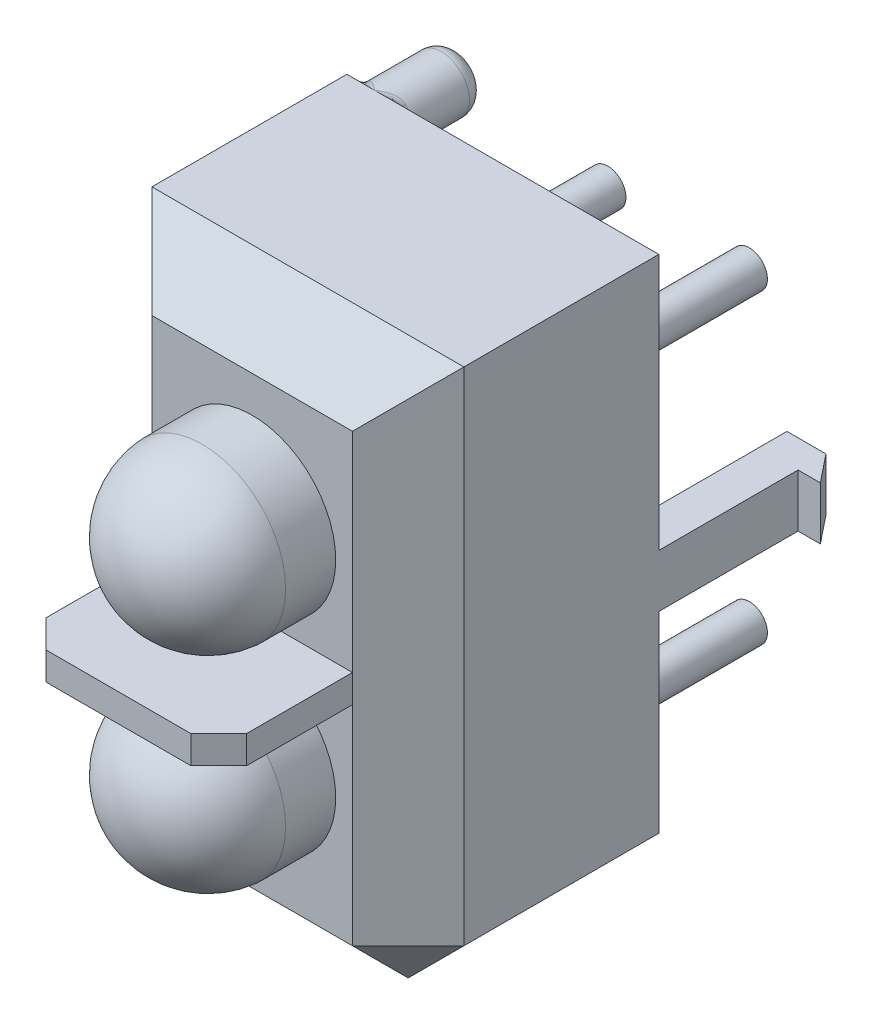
SolidWorks part; units mm, degrees
ref_plane "Front Plane" through (0, 0, 0) normal (0, 0, 1) x (1, 0, 0)
ref_plane "Top Plane" through (0, 0, 0) normal (0, 1, 0) x (1, 0, 0)
ref_plane "Right Plane" through (0, 0, 0) normal (1, 0, 0) x (0, 0, -1)
sketch "Sketch1" plane through (0, 0, 0) normal (0, 0, 1) x (1, 0, 0)
  line L1 (-2.8, 5) -> (2.8, 5)
  line L2 (-2.8, 5) -> (-2.8, -5)
  line L3 (-2.8, -5) -> (2.8, -5)
  line L4 (2.8, 5) -> (2.8, -5)
  line L5 (-2.8, 5) -> (2.8, -5) construction
  line L6 (-2.8, -5) -> (2.8, 5) construction
  point P0 (0, 0)
  dimension "D1" = 10
  dimension "D2" = 5.6
extrude "Boss-Extrude1" add sketch "Sketch1" along normal blind 4.5
chamfer "Chamfer1" distance 1 angle 45 6 edges at (2.8, -5, 2.25) (-2.8, -5, 2.25) (2.8, 0, 4.5) (0, -5, 4.5) (0, 5, 4.5) (-2.8, 0, 4.5)
sketch "Sketch2" plane through (0, 0, 4.5) normal (0, 0, 1) x (1, 0, 0)
  line L0 (0, 1.85) -> (0, -1.85) construction
  line L1 (-1.6378, 0) -> (1.752, 0) construction
  circle A0 centre (0, 1.85) radius 1.5
  circle A1 centre (0, -1.85) radius 1.5
  dimension "D2" = 3
  dimension "D3" = 3
  dimension "D1" = 3.7
extrude "Boss-Extrude2" add sketch "Sketch2" along normal blind 0.9
dome "Dome1" faces to dome 2 distance 1.4 parameters "D1"=1.4
dome "Dome2" faces to dome 2 distance 1.4 parameters "D1"=1.4
sketch "Sketch3" plane through (0, 0, 4.5) normal (0, 0, 1) x (1, 0, 0)
  line L0 (1.8, -4) -> (1.8, 4) construction
  line L1 (-1.8, -0.25) -> (1.8, -0.25)
  line L2 (-1.8, -0.25) -> (-1.8, 0.25)
  line L3 (-1.8, 0.25) -> (1.8, 0.25)
  line L4 (1.8, -0.25) -> (1.8, 0.25)
  line L5 (-1.8, -0.25) -> (1.8, 0.25) construction
  line L6 (-1.8, 0.25) -> (1.8, -0.25) construction
  point P0 (0, 0)
  dimension "D1" = 0.5
extrude "Boss-Extrude3" add sketch "Sketch3" along normal blind 2.4
chamfer "Chamfer2" distance 0.5 angle 45 2 edges at (-1.8, 0, 6.9) (1.8, 0, 6.9)
sketch "Sketch4" plane through (0, 0, 0) normal (0, 0, -1) x (-1, 0, 0)
  line L1 (2.8, 5) -> (2.8, -4) construction
  circle A0 centre (2.3, 4.5) radius 0.5
  dimension "D1" = 1
  dimension "D2" = 0.5
  dimension "D3" = 0.5
extrude "Boss-Extrude4" add sketch "Sketch4" along normal blind 1.5
fillet "Fillet1" radius 0.3 1 edges at (-2.8, 4.5, -1.5)
fillet "Fillet2" radius 0.2 2 edges at (-1.9464, 4.1464, 0) (-2.6536, 4.8536, 0)
sketch "Sketch5" plane through (0, 0, 0) normal (0, 0, -1) x (-1, 0, 0)
  line L0 (2.3556, 4.3522) -> (2.3556, -5.5035) construction
  line L1 (2.3556, 4.4706) -> (-4.7497, 4.4706) construction
  line L2 (2.3556, -0.1794) -> (-4.7497, -0.1794) construction
  line L3 (-0.0944, 4.3522) -> (-0.0944, -5.5035) construction
  line L4 (-1.9944, 4.3522) -> (-1.9944, -5.5035) construction
  line L5 (1.8056, 4.3522) -> (1.8056, -5.5035) construction
  line L6 (-2.8, -4) -> (-2.8, 5) construction
  line L7 (-2.1, -0.5521) -> (-2.8, -0.5521)
  line L8 (-2.1, -0.5521) -> (-2.1, 0.3979)
  line L9 (-2.1, 0.3979) -> (-2.8, 0.3979)
  line L10 (-2.8, -0.5521) -> (-2.8, 0.3979)
  line L11 (-2.1, -0.5521) -> (-2.8, 0.3979) construction
  line L12 (-2.1, 0.3979) -> (-2.8, -0.5521) construction
  line L13 (2.8, -0.5521) -> (2.1, -0.5521)
  line L14 (2.8, -0.5521) -> (2.8, 0.3979)
  line L15 (2.8, 0.3979) -> (2.1, 0.3979)
  line L16 (2.1, -0.5521) -> (2.1, 0.3979)
  line L17 (2.8, -0.5521) -> (2.1, 0.3979) construction
  line L18 (2.8, 0.3979) -> (2.1, -0.5521) construction
  line L19 (-2.1, -0.5521) -> (2.8, -0.5521) construction
  line L20 (2.8, 4.0101) -> (2.8, -4) construction
  dimension "D4" = 0.95
  dimension "D5" = 0.7
  dimension "D6" = 0
  dimension "D9" = 0
  dimension "D1" = 2.45
  dimension "D2" = 1.9
  dimension "D3" = 1.9
  dimension "D7" = 2
extrude "Boss-Extrude5" add sketch "Sketch5" along normal blind 3
sketch "Sketch8" plane through (0, 0, 0) normal (0, 0, -1) x (-1, 0, 0)
  line L0 (2.3, 4.5062) -> (2.3, -7.5109) construction
  line L1 (-0.155, 4.5062) -> (-0.155, -7.5109) construction
  line L2 (2.3, 4.5) -> (-6.037, 4.5) construction
  line L3 (2.3, -0.15) -> (-6.037, -0.15) construction
  line L5 (2.3, 2.59) -> (-6.037, 2.59) construction
  line L6 (2.3, -2.89) -> (-6.037, -2.89) construction
  line L7 (-1.425, 4.5062) -> (-1.425, -7.5109) construction
  line L8 (1.115, 4.5062) -> (1.115, -7.5109) construction
  line L9 (-1.425, 2.59) -> (1.115, 2.59) construction
  circle A0 centre (-1.425, 2.59) radius 0.325
  circle A1 centre (1.115, 2.59) radius 0.325
  circle A2 centre (1.115, -2.91) radius 0.325
  circle A3 centre (-1.425, -2.91) radius 0.325
  dimension "D6" = 0.65
  dimension "D7" = 2
  dimension "D9" = 2.54
  dimension "D1" = 4.65
  dimension "D2" = 2.74
  dimension "D3" = 2.74
  dimension "D4" = 1.27
  dimension "D5" = 1.27
  dimension "D8" = 2
extrude "Boss-Extrude6" add sketch "Sketch8" along normal blind 3 separate body
sketch "Sketch9" plane through (2.8, 0, 0) normal (1, 0, 0) x (0, 0, -1)
  line L0 (3, -0.5521) -> (0, -0.5521) construction
  line L1 (3, 0.3979) -> (2.5, 0.3979)
  line L2 (3, 0.3979) -> (3, -0.5521)
  line L3 (3, -0.5521) -> (2.5, -0.5521)
  line L4 (2.5, 0.3979) -> (2.5, -0.5521)
  dimension "D1" = 0.5
extrude "Boss-Extrude7" add sketch "Sketch9" along normal blind 0.4
sketch "Sketch10" plane through (0, -0.5521, 0) normal (0, -1, 0) x (1, 0, 0)
  line L0 (3.2, -2.5) -> (2.8, -3)
  line L1 (3.2, -3) -> (2.1, -3) construction
extrude "Cut-Extrude1" cut sketch "Sketch10" against normal through all and the other way through all
sketch "Sketch11" plane through (-2.8, 0, 0) normal (-1, 0, 0) x (0, 0, 1)
  line L0 (-3, -0.5521) -> (0, -0.5521) construction
  line L1 (-3, 0.3979) -> (-2.5, 0.3979)
  line L2 (-3, 0.3979) -> (-3, -0.5521)
  line L3 (-3, -0.5521) -> (-2.5, -0.5521)
  line L4 (-2.5, 0.3979) -> (-2.5, -0.5521)
  dimension "D1" = 0.5
extrude "Boss-Extrude8" add sketch "Sketch11" along normal blind 0.4
sketch "Sketch12" plane through (0, 0.3979, 0) normal (0, 1, 0) x (1, 0, 0)
  line L0 (-3.2, 2.5) -> (-2.8, 3)
  line L1 (-3.2, 3) -> (-2.1, 3) construction
extrude "Cut-Extrude2" cut sketch "Sketch12" against normal through all and the other way through all
